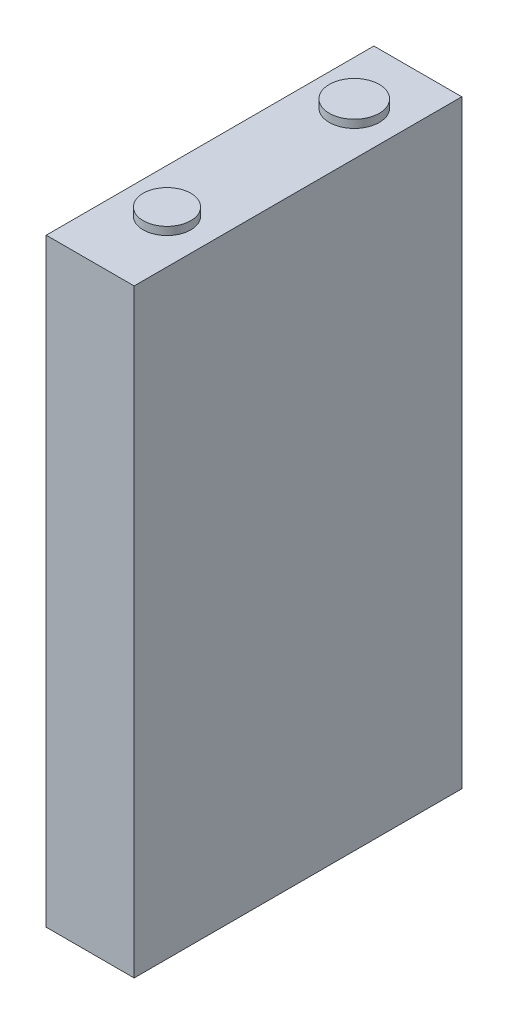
SolidWorks part; units mm, degrees
ref_plane "Front Plane" through (0, 0, 0) normal (0, 0, 1) x (1, 0, 0)
ref_plane "Top Plane" through (0, 0, 0) normal (0, 1, 0) x (1, 0, 0)
ref_plane "Right Plane" through (0, 0, 0) normal (1, 0, 0) x (0, 0, -1)
sketch "Sketch1" plane through (0, 0, 0) normal (1, 0, 0) x (0, 0, -1)
  line L1 (-65.0875, -119.0625) -> (65.0875, -119.0625)
  line L2 (-65.0875, -119.0625) -> (-65.0875, 119.0625)
  line L3 (-65.0875, 119.0625) -> (65.0875, 119.0625)
  line L4 (65.0875, -119.0625) -> (65.0875, 119.0625)
  line L5 (-65.0875, -119.0625) -> (65.0875, 119.0625) construction
  line L6 (-65.0875, 119.0625) -> (65.0875, -119.0625) construction
  point P0 (0, 0)
  dimension "D1" = 238.125
  dimension "D2" = 130.175
extrude "Boss-Extrude1" add sketch "Sketch1" along normal mid plane 34.925
sketch "Sketch2" plane through (0, 119.0625, 0) normal (0, 1, 0) x (1, 0, 0)
  circle A0 centre (0, 39.841) radius 9.931
  circle A1 centre (0, -34.5653) radius 9.446
extrude "Boss-Extrude2" add sketch "Sketch2" along normal mid plane 6.35
